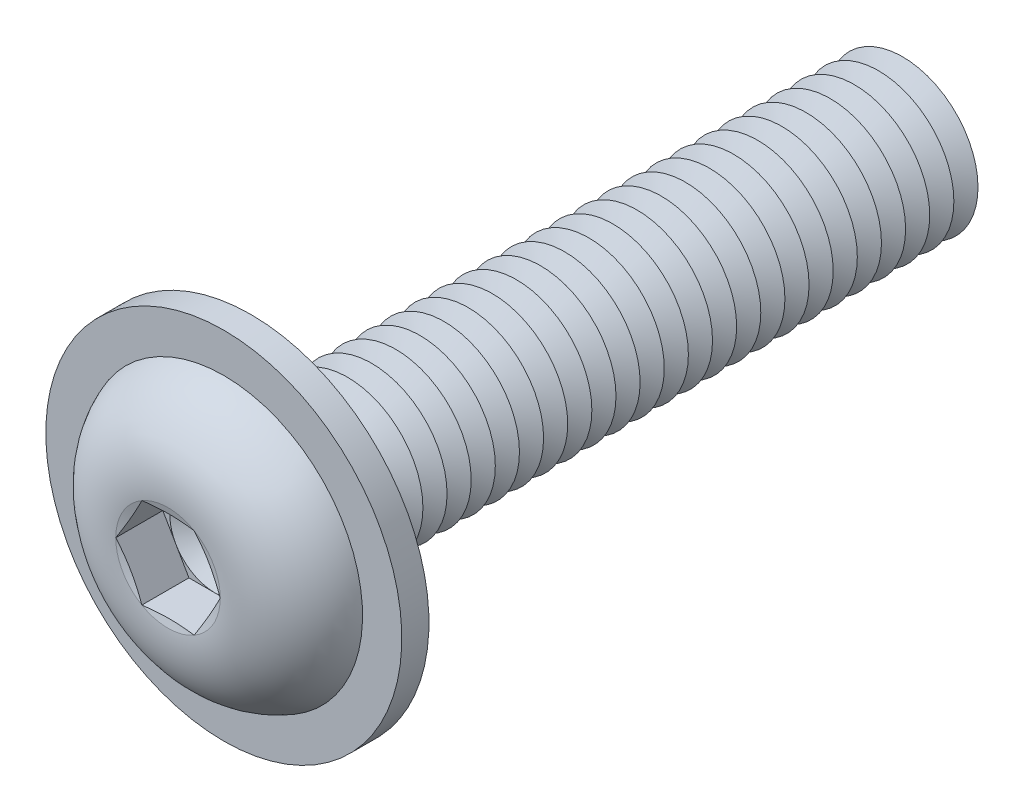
SolidWorks part; units mm, degrees
ref_plane "Front Plane" through (0, 0, 0) normal (0, 0, 1) x (1, 0, 0)
ref_plane "Top Plane" through (0, 0, 0) normal (0, 1, 0) x (1, 0, 0)
ref_plane "Right Plane" through (0, 0, 0) normal (1, 0, 0) x (0, 0, -1)
sketch "Sketch1" plane through (0, 0, 0) normal (1, 0, 0) x (0, 0, -1)
  line L0 (0, 2.5) -> (0, 4.75)
  line L3 (0, 2.5) -> (22, 2.5)
  line L4 (22, 2.5) -> (22, 0)
  line L5 (22, 0) -> (-2.75, 0) construction
  line L6 (-2.75, 0) -> (22, 0)
  line L7 (-2.75, 1.732) -> (-2.75, 0.866) construction
  line L8 (-2.75, 0.866) -> (-2.75, 0)
  line L9 (-2.75, 1.732) -> (-2.5179, 0.866)
  line L10 (-2.5179, 0.866) -> (-2.75, 0.866)
  line L11 (22, 0) -> (22.7481, 0) construction
  line L12 (0, 4.75) -> (-2.75, 4.75) construction
  arc A1 (0, 4.75) -> (-2.75, 1.732) centre (0, 1.9881) ccw
  point P8 (22, 1.25)
  dimension "D1" = 9.5
  dimension "D2" = 5
  dimension "D3" = 2.75
  dimension "D4" = 3.4641
  dimension "D5" = 22
  dimension "D6" = 15
revolve "Revolve1" add sketch "Sketch1" angle 360 about L5
fillet "Fillet1" radius 0.4 1 edges at (-2.5, 0, 0)
sketch "Sketch2" plane through (0, 0, 0) normal (1, 0, 0) x (0, 0, -1)
  line L0 (21.6, 2.5) -> (22.4, 2.5)
  line L1 (22, 2.5) -> (0.4, 2.5) construction
  line L2 (22.4, 2.5) -> (22, 1.8072)
  line L3 (22, -2.5) -> (22, 2.5) construction
  line L4 (22, 1.8072) -> (21.6, 2.5)
  dimension "D1" = 0.8
revolve "Cut-Revolve1" cut sketch "Sketch2" angle 360 about axis through (0, 0, -22) along (0, 0, -1)
pattern_linear "LPattern1" count 27 spacing 0.8 along (0, 0, 1) of "Cut-Revolve1"
sketch "Sketch3" plane through (0, 0, 2.75) normal (0, 0, 1) x (1, 0, 0)
  line L7 (0.866, 1.5) -> (-0.866, 1.5)
  line L8 (-0.866, 1.5) -> (-1.7321, 0)
  line L9 (-1.7321, 0) -> (-0.866, -1.5)
  line L10 (-0.866, -1.5) -> (0.866, -1.5)
  line L11 (0.866, -1.5) -> (1.732, 0)
  line L12 (1.732, 0) -> (0.866, 1.5)
  circle A0 centre (0, 0) radius 1.5 construction
  circle A3 centre (0, 0) radius 1.7321 construction
extrude "Cut-Extrude1" cut sketch "Sketch3" against normal blind 1.56
sketch "Sketch4" plane through (0, 0, 1.19) normal (0, 0, 1) x (1, 0, 0)
  line L1 (0.866, 1.5) -> (-0.866, 1.5) construction
  circle A0 centre (0, 0) radius 1.5
extrude "Cut-Extrude2" cut sketch "Sketch4" against normal through all draft 60
sketch "Sketch5" plane through (0, 0, 0) normal (0, 0, -1) x (-1, 0, 0)
  circle A0 centre (0, 0) radius 5.9
  circle A1 centre (0, 0) radius 2.9
  circle A2 centre (0, 0) radius 2.9 construction
  dimension "D1" = 11.8
extrude "Boss-Extrude1" add sketch "Sketch5" against normal blind 0.9
